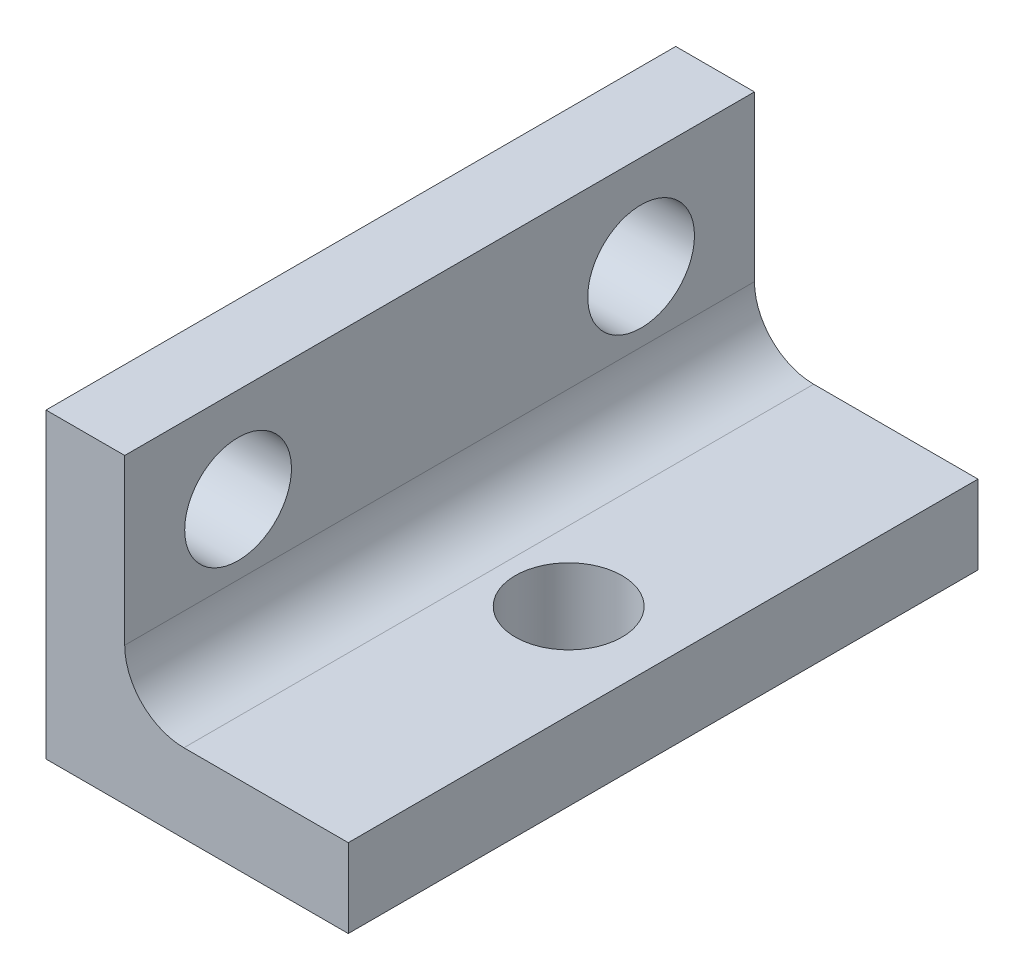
SolidWorks part; units mm, degrees
ref_plane "Front" through (0, 0, 0) normal (0, 0, 1) x (1, 0, 0)
ref_plane "Top" through (0, 0, 0) normal (0, 1, 0) x (1, 0, 0)
ref_plane "Right" through (0, 0, 0) normal (1, 0, 0) x (0, 0, -1)
sketch "Sketch1" plane through (0, 0, 0) normal (0, 0, 1) x (1, 0, 0)
  line L0 (3.175, 12.192) -> (3.175, 5.5626)
  line L1 (0, 0) -> (12.192, 0)
  line L2 (0, 0) -> (0, 12.192)
  line L3 (0, 12.192) -> (3.175, 12.192)
  line L4 (12.192, 0) -> (12.192, 3.175)
  line L5 (5.5626, 3.175) -> (12.192, 3.175)
  arc A0 (3.175, 5.5626) -> (5.5626, 3.175) centre (5.5626, 5.5626) ccw
  dimension "D1" = 2.3876
  dimension "D2" = 3.175
  dimension "D3" = 3.175
  dimension "D4" = 12.192
extrude "Extrude1" add sketch "Sketch1" along normal blind 12.7
hole_wizard "#18 (0.169500) Diameter Hole2" positions "Sketch9" profile "Sketch8" hole size "#18" standard "Ansi Inch"
sketch "Sketch9" plane through (0, 0, 0) normal (-1, 0, 0) x (0, 0, 1)
  line L0 (12.7, 12.192) -> (0, 12.192) construction
  line L1 (12.7, 12.192) -> (12.7, 0) construction
  point P0 (8.128, 8.382)
  dimension "D1" = 3.81
  dimension "D2" = 4.572
sketch "Sketch8" plane through (0, 8.382, 8.128) normal (0, 1, 0) x (0, 0, 1)
  line L0 (0, 0) -> (0, 12.192)
  line L1 (0, 12.192) -> (2.1526, 12.192)
  line L2 (2.1526, 12.192) -> (2.1526, 0)
  line L5 (2.1526, 0) -> (0, 0)
  line L11 (0, -6.35) -> (0, 107.95) construction
  dimension "Thru Hole Dia." = 4.3053
  dimension "Thru Hole Depth" = 12.192
hole_wizard "#18 (0.169500) Diameter Hole3" positions "Sketch11" profile "Sketch10" hole size "#18" standard "Ansi Inch"
sketch "Sketch11" plane through (0, 0, 0) normal (0, -1, 0) x (1, 0, 0)
  line L0 (12.192, 12.7) -> (12.192, 0) construction
  point P0 (8.382, 0)
  dimension "D1" = 3.81
sketch "Sketch10" plane through (8.382, 0, 0) normal (1, 0, 0) x (0, 0, -1)
  line L0 (0, 0) -> (0, 12.192)
  line L1 (0, 12.192) -> (2.1526, 12.192)
  line L2 (2.1526, 12.192) -> (2.1526, 0)
  line L5 (2.1526, 0) -> (0, 0)
  line L11 (0, -6.35) -> (0, 107.95) construction
  dimension "Thru Hole Dia." = 4.3053
  dimension "Thru Hole Depth" = 12.192
mirror "Mirror1"
